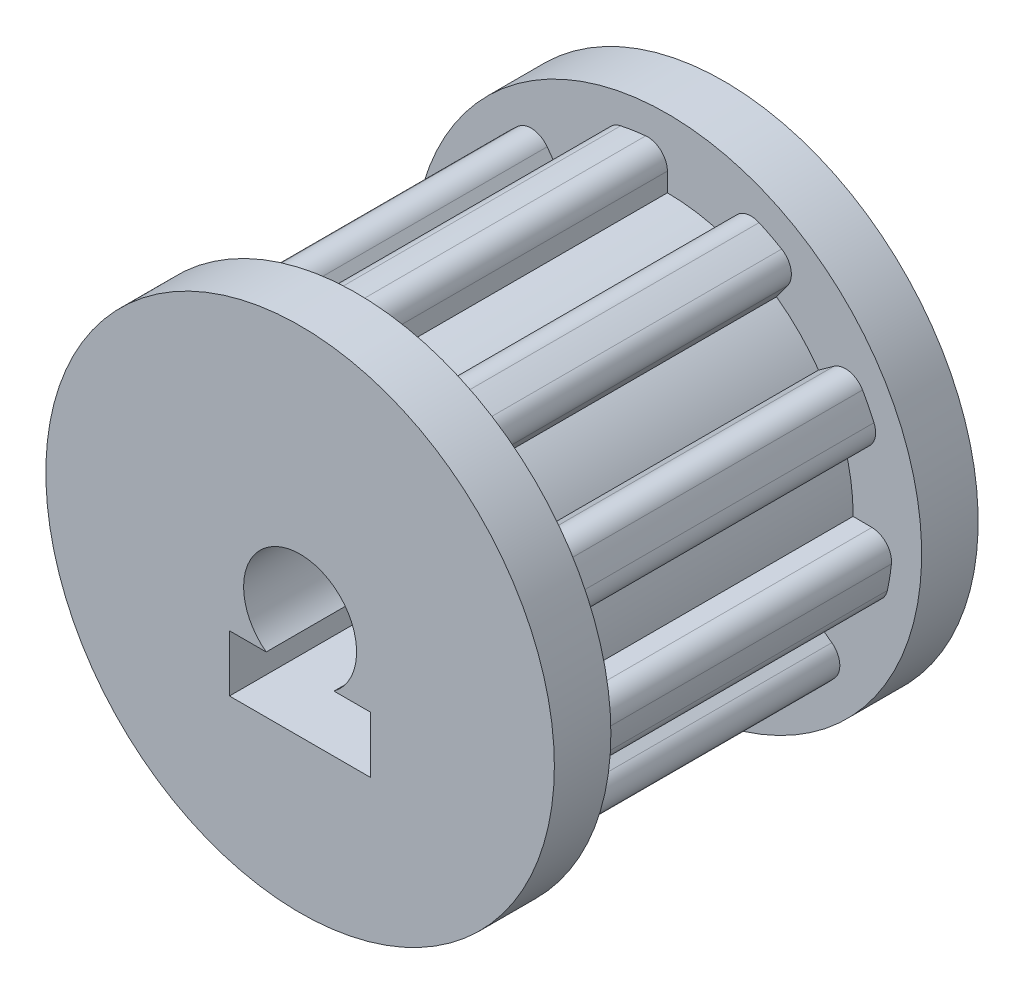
SolidWorks part; units mm, degrees
ref_plane "Plan de face" through (0, 0, 0) normal (0, 0, 1) x (1, 0, 0)
ref_plane "Plan de dessus" through (0, 0, 0) normal (0, 1, 0) x (1, 0, 0)
ref_plane "Plan de droite" through (0, 0, 0) normal (1, 0, 0) x (0, 0, -1)
sketch "Esquisse1" plane through (0, 0, 0) normal (0, 0, 1) x (1, 0, 0)
  line L0 (0, 0) -> (0, 73.512) construction
  line L2 (0, 0) -> (-22.5534, 71.5304) construction
  line L3 (-1.9767, 6.2694) -> (0, 6.5736) construction
  line L4 (-2.3977, 7.6046) -> (-1.9767, 6.2694)
  line L5 (0, 7.9736) -> (0, 6.5736)
  arc A0 (0, 6.5736) -> (-1.9767, 6.2694) centre (0, 0) ccw
  arc A1 (0, 7.9736) -> (-2.3977, 7.6046) centre (0, 0) ccw
  dimension "D3" = 2
  dimension "D2" = 17.5
  dimension "D4" = 1.4
extrude "Boss.-Extru.2" add sketch "Esquisse1" along normal blind 11
fillet "Congé1" radius 0.7 2 edges at (-2.3977, 7.6046, 5.5) (0, 7.9736, 5.5)
sketch "Esquisse2" plane through (0, 0, 0) normal (0, 0, -1) x (-1, 0, 0)
  circle A0 centre (0, 0) radius 6.5736
extrude "Boss.-Extru.3" add sketch "Esquisse2" against normal blind 11
pattern_circular "Répétition circulaire1" count 10 every 36 about axis through (0, 0, 0) along (0, 0, 1) of "Boss.-Extru.2", "Congé1"
sketch "Esquisse3" plane through (0, 0, 0) normal (0, 0, -1) x (-1, 0, 0)
  circle A0 centre (0, 0) radius 9
  dimension "D1" = 18
extrude "Boss.-Extru.4" add sketch "Esquisse3" along normal blind 2
sketch "Esquisse4" plane through (0, 0, 11) normal (0, 0, 1) x (1, 0, 0)
  circle A0 centre (0, 0) radius 11
  dimension "D1" = 22
sketch "Esquisse5" plane through (0, 0, -2) normal (0, 0, -1) x (-1, 0, 0)
  circle A0 centre (0, 0) radius 2
  dimension "D1" = 4
sketch "Esquisse6" plane through (0, 0, 11) normal (0, 0, 1) x (1, 0, 0)
  circle A0 centre (0, 0) radius 9
  dimension "D1" = 18
extrude "Boss.-Extru.6" add sketch "Esquisse6" along normal blind 2
extrude "Enlèv. mat.-Extru.1" cut sketch "Esquisse5" against normal through all
sketch "Esquisse7" plane through (0, 0, 13) normal (0, 0, 1) x (1, 0, 0)
  line L1 (-2.5, -1.6) -> (2.5, -1.6)
  line L2 (-2.5, -1.6) -> (-2.5, -3.6)
  line L3 (-2.5, -3.6) -> (2.5, -3.6)
  line L4 (2.5, -1.6) -> (2.5, -3.6)
  circle A0 centre (0, 0) radius 2 construction
  dimension "D4" = 1.6
  dimension "D1" = 2
  dimension "D2" = 5
  dimension "D3" = 2.5
extrude "Enlèv. mat.-Extru.2" cut sketch "Esquisse7" against normal blind 6
